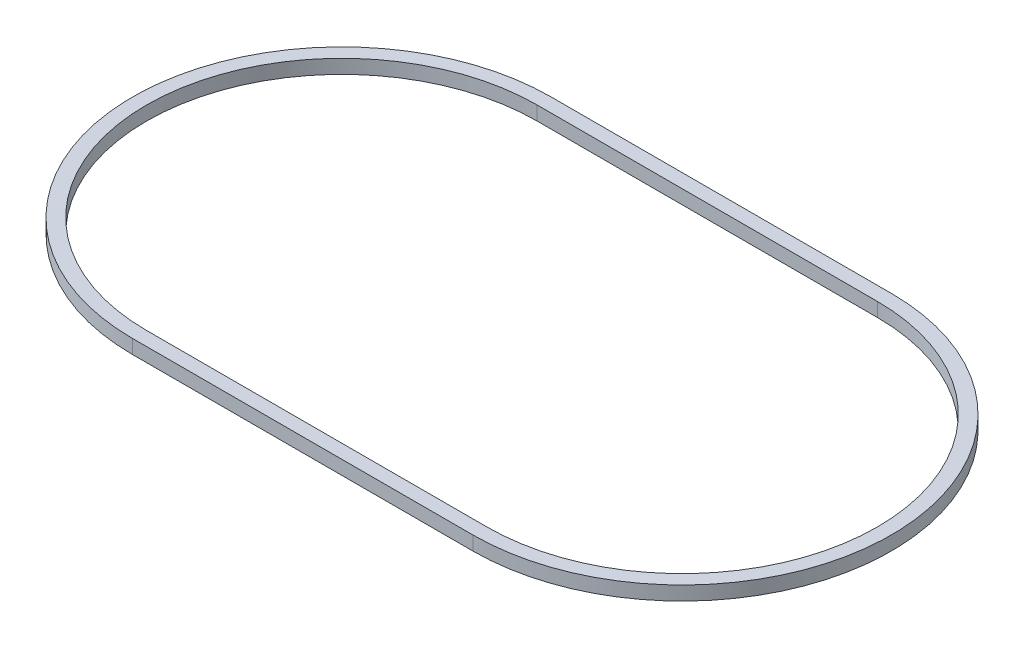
SolidWorks part; units mm, degrees
ref_plane "Ön Düzlem" through (0, 0, 0) normal (0, 0, 1) x (1, 0, 0)
ref_plane "Üst Düzlem" through (0, 0, 0) normal (0, 1, 0) x (1, 0, 0)
ref_plane "Sağ Düzlem" through (0, 0, 0) normal (1, 0, 0) x (0, 0, -1)
sketch "Sketch1" plane through (0, 0, 0) normal (0, 1, 0) x (1, 0, 0)
  line L0 (30.5, 0) -> (-30.5, 0) construction
  line L1 (30.5, -35) -> (-30.5, -35)
  line L2 (30.5, 35) -> (-30.5, 35)
  line L3 (30.5, -37.5) -> (-30.5, -37.5)
  line L4 (30.5, 37.5) -> (-30.5, 37.5)
  arc A0 (30.5, -35) -> (30.5, 35) centre (30.5, 0) ccw
  arc A1 (-30.5, 35) -> (-30.5, -35) centre (-30.5, 0) ccw
  arc A2 (-30.5, 37.5) -> (-30.5, -37.5) centre (-30.5, 0) ccw
  arc A3 (30.5, -37.5) -> (30.5, 37.5) centre (30.5, 0) ccw
  point P2 (0, 0)
  point P14 (74.1435, 0)
  point P15 (0, 0)
  dimension "D2" = 35
  dimension "D3" = 37.5
  dimension "D1" = 61
extrude "Boss-Extrude1" add sketch "Sketch1" along normal blind 2.5
